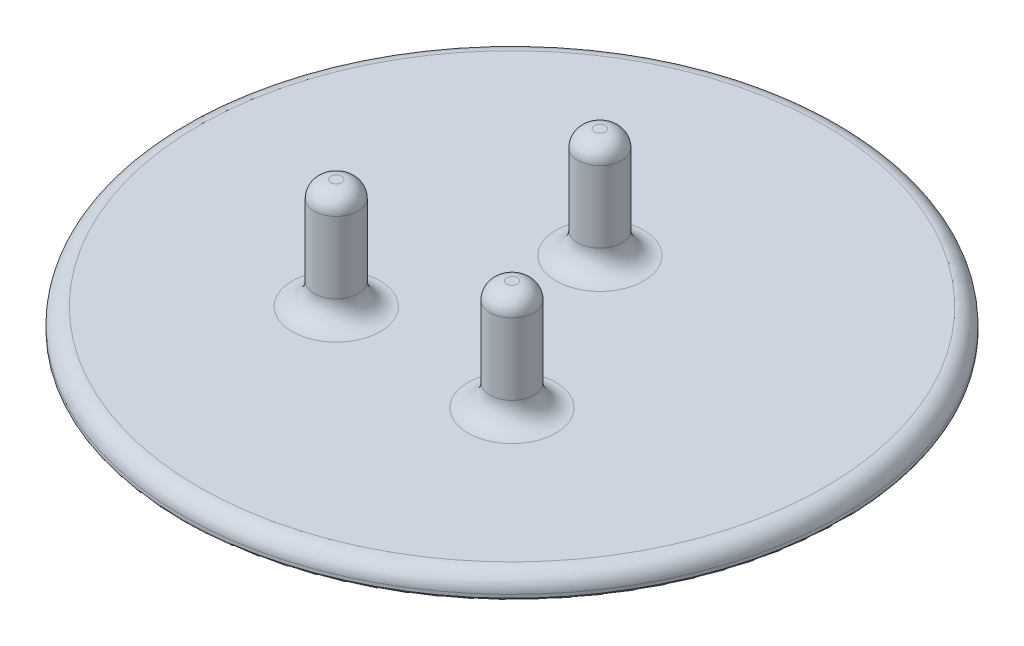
SolidWorks part; units mm, degrees
ref_plane "Front Plane" through (0, 0, 0) normal (0, 0, 1) x (1, 0, 0)
ref_plane "Top Plane" through (0, 0, 0) normal (0, 1, 0) x (1, 0, 0)
ref_plane "Right Plane" through (0, 0, 0) normal (1, 0, 0) x (0, 0, -1)
sketch "Sketch1" plane through (0, 0, 0) normal (0, 1, 0) x (1, 0, 0)
  circle A0 centre (0, 0) radius 30
extrude "Boss-Extrude1" add sketch "Sketch1" along normal blind 2
sketch "Sketch2" plane through (0, 2, 0) normal (0, 1, 0) x (1, 0, 0)
  line L0 (0, 8) -> (0, 0) construction
  line L1 (0, 0) -> (0, -3) construction
  line L2 (0, 8) -> (8, -8) construction
  line L3 (8, -8) -> (0, 8) construction
  line L4 (0, 8) -> (-8, -8) construction
  circle A0 centre (0, 8) radius 2
  circle A1 centre (-8, -8) radius 2
  circle A2 centre (8, -8) radius 2
  dimension "D1" = 16
  dimension "D3" = 16
  dimension "D7" = 4
  dimension "D2" = 8
  dimension "D6" = 8
extrude "Boss-Extrude2" add sketch "Sketch2" along normal blind 10
fillet "Fillet1" radius 2 3 edges at (0, 2, -6) (8, 2, 10) (-8, 2, 10)
fillet "Fillet3" radius 1.5 4 edges at (0, 2, 30) (8, 12, 10) (0, 12, -6) (-8, 12, 10)
sketch "Sketch3" plane through (0, 0, 0) normal (0, -1, 0) x (1, 0, 0)
  line L1 (2.275, -2.275) -> (-2.275, -2.275)
  line L2 (2.275, -2.275) -> (2.275, 2.275)
  line L3 (2.275, 2.275) -> (-2.275, 2.275)
  line L4 (-2.275, -2.275) -> (-2.275, 2.275)
  line L5 (2.275, -2.275) -> (-2.275, 2.275) construction
  line L6 (2.275, 2.275) -> (-2.275, -2.275) construction
  line L7 (-2.275, 12.275) -> (2.275, 12.275)
  line L8 (-2.275, 12.275) -> (-2.275, 7.725)
  line L9 (-2.275, 7.725) -> (2.275, 7.725)
  line L10 (2.275, 12.275) -> (2.275, 7.725)
  line L11 (-2.275, 12.275) -> (2.275, 7.725) construction
  line L12 (-2.275, 7.725) -> (2.275, 12.275) construction
  line L13 (12.275, -2.275) -> (7.725, -2.275)
  line L14 (12.275, -2.275) -> (12.275, 2.275)
  line L15 (12.275, 2.275) -> (7.725, 2.275)
  line L16 (7.725, -2.275) -> (7.725, 2.275)
  line L17 (12.275, -2.275) -> (7.725, 2.275) construction
  line L18 (12.275, 2.275) -> (7.725, -2.275) construction
  line L19 (2.275, -12.275) -> (-2.275, -12.275)
  line L20 (2.275, -12.275) -> (2.275, -7.725)
  line L21 (2.275, -7.725) -> (-2.275, -7.725)
  line L22 (-2.275, -12.275) -> (-2.275, -7.725)
  line L23 (2.275, -12.275) -> (-2.275, -7.725) construction
  line L24 (2.275, -7.725) -> (-2.275, -12.275) construction
  line L25 (-7.725, -2.275) -> (-12.275, -2.275)
  line L26 (-7.725, -2.275) -> (-7.725, 2.275)
  line L27 (-7.725, 2.275) -> (-12.275, 2.275)
  line L28 (-12.275, -2.275) -> (-12.275, 2.275)
  line L29 (-7.725, -2.275) -> (-12.275, 2.275) construction
  line L30 (-7.725, 2.275) -> (-12.275, -2.275) construction
  point P0 (0, 0)
  point P6 (0, 10)
  point P11 (10, 0)
  point P16 (0, -10)
  point P21 (-10, 0)
  dimension "D1" = 10
  dimension "D2" = 10
  dimension "D3" = 10
  dimension "D4" = 10
  dimension "D5" = 4.55
  dimension "D6" = 4.55
  dimension "D7" = 4.55
  dimension "D8" = 4.55
  dimension "D9" = 4.55
  dimension "D10" = 4.55
  dimension "D11" = 4.55
  dimension "D12" = 4.55
  dimension "D13" = 4.55
  dimension "D14" = 4.55
sketch "Sketch6" plane through (0, 0, 0) normal (0, -1, 0) x (1, 0, 0)
extrude "Boss-Extrude3" add sketch "Sketch3" along normal blind 2.3
fillet "Fillet4" radius 0.2 41 edges at (-10, 0, -2.275) (-7.725, 0, 0) (-10, 0, 2.275) (-12.275, 0, 0) (10, 0, -2.275) (12.275, 0, 0) (10, 0, 2.275) (7.725, 0, 0) (0, 0, -2.275) (2.275, 0, 0) (0, 0, 2.275) (-2.275, 0, 0) (0, 0, 30) (0, 0, 12.275) (-2.275, 0, 10) (0, 0, 7.725) (2.275, 0, 10) (0, 0, -12.275) (2.275, 0, -10) (0, 0, -7.725) (-2.275, 0, -10) (0, -2.3, -7.725) (2.275, -2.3, -10) (0, -2.3, -12.275) (-2.275, -2.3, -10) (10, -2.3, 2.275) (12.275, -2.3, 0) (10, -2.3, -2.275) (7.725, -2.3, 0) (0, -2.3, 7.725) (-2.275, -2.3, 10) (0, -2.3, 12.275) (2.275, -2.3, 10) (0, -2.3, 2.275) (2.275, -2.3, 0) (0, -2.3, -2.275) (-2.275, -2.3, 0) (-10, -2.3, 2.275) (-7.725, -2.3, 0) (-10, -2.3, -2.275) (-12.275, -2.3, 0)
